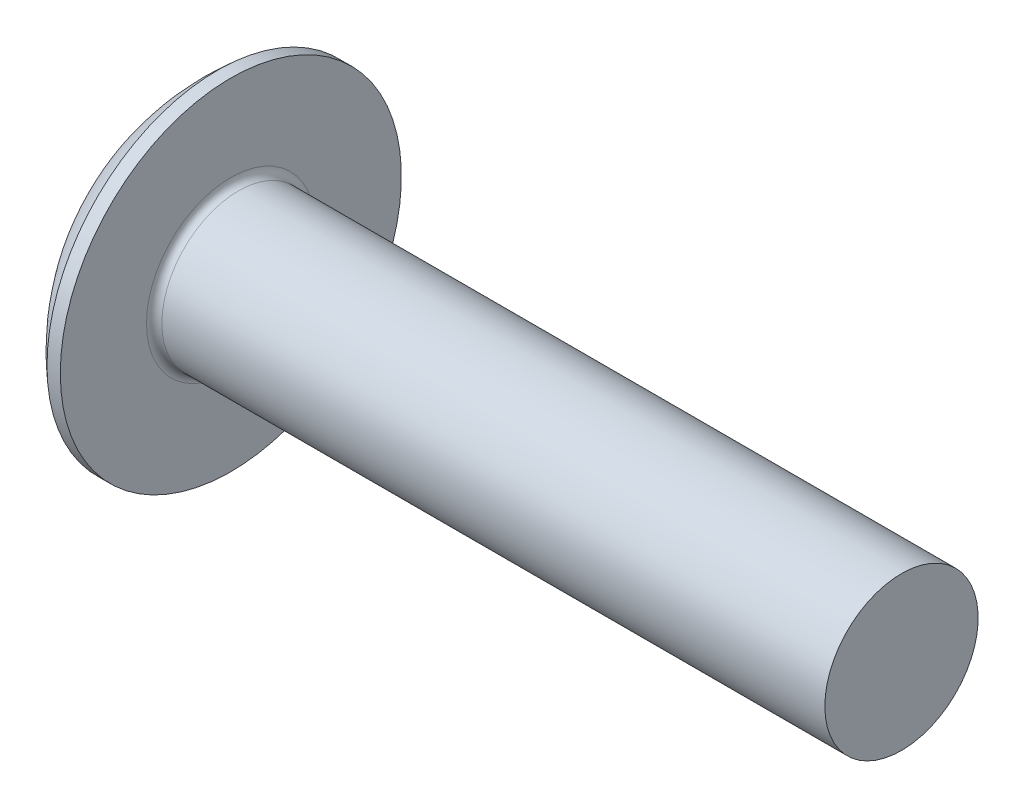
SolidWorks part; units mm, degrees
ref_plane "Plane1" through (0, 0, 0) normal (0, 0, 1) x (1, 0, 0)
ref_plane "Plane2" through (0, 0, 0) normal (0, 1, 0) x (1, 0, 0)
ref_plane "Plane3" through (0, 0, 0) normal (1, 0, 0) x (0, 0, -1)
sketch "BodySke" plane through (0, 0, 0) normal (0, 0, 1) x (1, 0, 0)
  line L0 (4.8, 4) -> (4.8, 8.9)
  line L1 (6.05, 6.35) -> (6.05, -3.175) construction
  line L2 (-25.4, 0) -> (127, 0) construction
  line L3 (39.8, 0) -> (0, 0)
  line L4 (4.8, 4) -> (39.8, 4)
  line L5 (39.8, 4) -> (39.8, 0)
  line L8 (9.8, 6.35) -> (9.8, -3.175) construction
  line L9 (4.8, 8.9) -> (4.1053, 8.9)
  arc A0 (4.1053, 8.9) -> (0, 0) centre (11.7, 0) ccw
  dimension "Oval_rad" = 11.7
  dimension "Head_ht" = 4.8
  dimension "Diameter" = 8
  dimension "Length" = 35
  dimension "Head_dia" = 17.8
  dimension "Advance" = 1.25
  dimension "Thread_nom" = 30
revolve "Base-Revolve" add sketch "BodySke"
fillet "Fillet1" radius 0.4 1 edges at (4.8, 0, 4)
sketch "Sketch3" plane through (0, 0, 0) normal (1, 0, 0) x (0, 0, -1)
  line L0 (0.71, -3.9) -> (-0.71, -3.9)
  line L1 (0.71, -3.9) -> (0.71, 3.9)
  line L2 (-0.71, 3.9) -> (0.71, 3.9)
  line L3 (-0.71, 3.9) -> (-0.71, -3.9)
  dimension "D1" = 3.9
  dimension "Cross_dia" = 7.8
  dimension "D2" = 0.71
  dimension "Cross_width" = 1.42
ref_plane "Plane4" through (4.36, 0, 0) normal (1, 0, 0) x (0, 0, -1)
sketch "Sketch4" plane through (4.36, 0, 0) normal (1, 0, 0) x (0, 0, -1)
  line L0 (0.71, -1.7262) -> (-0.71, -1.7262)
  line L1 (0.71, -1.7262) -> (0.71, 1.7262)
  line L2 (-0.71, 1.7262) -> (0.71, 1.7262)
  line L3 (-0.71, 1.7262) -> (-0.71, -1.7262)
  dimension "D1" = 1.42
  dimension "D2" = 3.4524
  dimension "D3" = 0.71
  dimension "D4" = 1.7262
loft "Recess" cut profiles "Sketch3", "Sketch4"
pattern_circular "RecPat" count 2 every 90 about axis through (0, 0, 0) along (1, 0, 0) of "Recess"
sketch "RecCorSke" plane through (0, 0, 0) normal (0, 0, 1) x (1, 0, 0)
  line L0 (-3.175, 0) -> (15.875, 0) construction
  line L1 (-25.4, 0) -> (127, 0) construction
  line L2 (0, 0) -> (0, 1.5854)
  line L3 (0, 1.5854) -> (4.36, 1.2805)
  line L4 (4.36, 1.2805) -> (4.7761, 0)
  line L5 (4.7761, 0) -> (0, 0)
  dimension "Diameter" = 2.561
  dimension "Depth" = 4.36
  dimension "Draft_angle" = 4
  dimension "Bottom_angle" = 18
revolve "RecessCore" cut sketch "RecCorSke" angle 360 about L0
sketch "ThdSchSke" plane through (0, 0, 0) normal (0, 0, 1) x (1, 0, 0)
  line L0 (9.8, -3.3095) -> (9.3165, -4)
  line L1 (9.8, -3.3095) -> (10.2835, -4)
  line L2 (10.2835, -4) -> (10.2835, -5)
  line L3 (-3.175, 0) -> (5.1513, 0) construction
  line L5 (10.2835, -5) -> (9.3165, -5)
  line L6 (9.3165, -5) -> (9.3165, -4)
  dimension "Thread_minor" = 6.619
  dimension "Diameter" = 8
  dimension "Start" = 9.8
  dimension "SideAngle" = 55
  dimension "VeeAngle" = 70
  dimension "Overcut" = 10
revolve "ThreadSchematic" [suppressed] cut sketch "ThdSchSke" angle 360 about L3
pattern_linear "ThdSchPat" [suppressed]
equation "' \"Diameter@BodySke\" = 8"
equation "' \"Length@BodySke\" = 35"
equation "' \"Head_dia@BodySke\" = 17.8"
equation "' \"Oval_rad@BodySke\" = 11.7"
equation "' \"Head_ht@BodySke\" = 4.8"
equation "' \"Thread_nom@BodySke\" =  30"
equation "' \"Cross_dia@Sketch3\" = 7.8"
equation "' \"Cross_width@Sketch3\" = 1.42"
equation "' \"Cross_depth@Plane4\" = 4.36"
equation "' \"Diameter@RecCorSke\" = 2.561"
equation "' \"Radius@Fillet1\" = 0.4"
equation "' \"Thread_minor@ThreadCosmetic\" = 6.619"
equation "' \"Advance@BodySke\" = 1.25"
equation "\"D1@Sketch3\" = \"Cross_dia@Sketch3\" / 2"
equation "\"D2@Sketch3\" = \"Cross_width@Sketch3\" / 2"
equation "\"Depth@RecCorSke\" = \"Cross_depth@Plane4\""
equation "\"D1@Sketch4\" = \"Cross_width@Sketch3\""
equation "\"D2@Sketch4\" = \"Cross_dia@Sketch3\" - 2.0 * \"Cross_depth@Plane4\" * tan(26.5  * 0.017453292)"
equation "\"D3@Sketch4\" = \"D1@Sketch4\" / 2"
equation "\"D4@Sketch4\" = \"D2@Sketch4\" / 2"
equation "\"Thread_length@ThreadCosmetic\" = ((sgn( (\"Length@BodySke\" - \"Advance@BodySke\" * 2.0 ) - \"Thread_nom@BodySke\" )-1)*( (\"Length@BodySke\" - \"Advance@BodySke\" * 2.0 ) - \"Thread_nom@BodySke\" ))/-2+ \"Thread_"
equation "\"Thread_minor@ThdSchSke\" = \"Thread_minor@ThreadCosmetic\""
equation "\"Diameter@ThdSchSke\" = \"Diameter@BodySke\""
equation "\"Overcut@ThdSchSke\" = \"Diameter@BodySke\" * 1.25"
equation "\"Start@ThdSchSke\" = \"Head_ht@BodySke\" + \"Length@BodySke\" - \"Thread_length@ThreadCosmetic\"  '---Non-countersunk---"
equation "\"Num_threads@ThdSchPat\" = int( \"Thread_length@ThreadCosmetic\" / \"Advance@BodySke\" + 0.999 )  + 1"
equation "\"Advance@ThdSchPat\" = \"Thread_length@ThreadCosmetic\" /  (\"Num_threads@ThdSchPat\" - 1) 'relax it"
